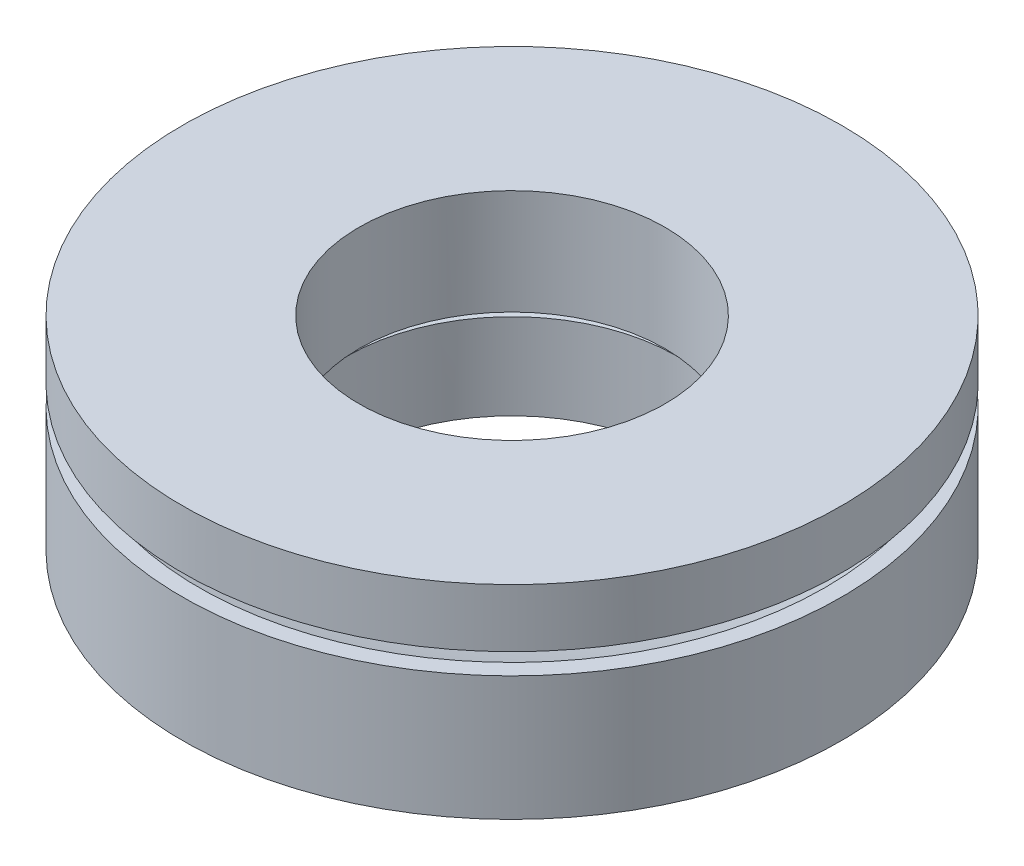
SolidWorks part; units mm, degrees
ref_plane "Front Plane" through (0, 0, 0) normal (0, 0, 1) x (1, 0, 0)
ref_plane "Top Plane" through (0, 0, 0) normal (0, 1, 0) x (1, 0, 0)
ref_plane "Right Plane" through (0, 0, 0) normal (1, 0, 0) x (0, 0, -1)
sketch "Sketch1" plane through (0, 0, 0) normal (0, 0, 1) x (1, 0, 0)
  line L0 (-11.1125, 6.858) -> (-11.1125, 4.8986)
  line L1 (-11.1125, 6.858) -> (-5.1594, 6.858)
  line L2 (-5.1594, 6.858) -> (-5.1594, 3.3124)
  line L3 (0, 0) -> (0, 5.842) construction
  line L4 (-11.1125, 4.1922) -> (-11.1125, 0)
  line L5 (-11.1125, 0) -> (-5.5562, 0)
  line L6 (-5.5562, 0) -> (-5.5563, 2.8966)
  line L7 (-11.1125, 4.1922) -> (-10.5569, 4.1922)
  line L8 (0, 4.8986) -> (0, 4.3906) construction
  arc A0 (-11.1125, 4.8986) -> (-5.1594, 3.3124) centre (0, 34.6404) ccw
  arc A1 (-5.5563, 2.8966) -> (-10.5569, 4.1922) centre (0, 34.6404) cw
  point P8 (-11.1125, 4.3906)
  dimension "D3" = 21.1137
  dimension "R" = 31.75
  dimension "D1" = 1.9594
  dimension "A" = 10.3187
  dimension "D2" = 0.508
  dimension "B" = 22.225
  dimension "E" = 11.1125
  dimension "C" = 22.225
  dimension "max height" = 6.858
  dimension "min height" = 5.842
revolve "Revolve1" add sketch "Sketch1" angle 360 about L3
delete or keep bodies "Body-Delete1" [suppressed] type delete bodies bodies 101
delete or keep bodies "Body-Delete2" [suppressed] type delete bodies bodies 102
equation "\"D1@Sketch1\" = \"max height@Sketch1\"/3.5"
equation "\"D3@Sketch1\" = \"C@Sketch1\"*.95"
equation "\"D2@Sketch1\" = \"max height@Sketch1\"/2-\"min height@Sketch1\"/2"
